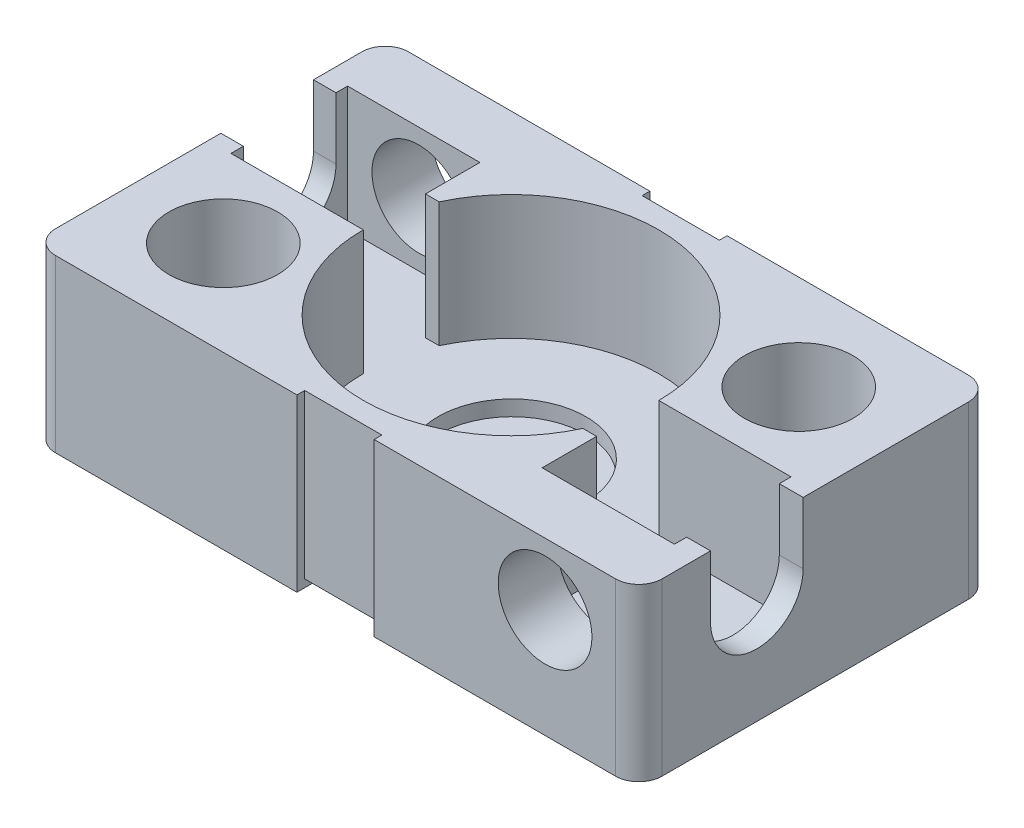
SolidWorks part; units mm, degrees
ref_plane "Front Plane" through (0, 0, 0) normal (0, 0, 1) x (1, 0, 0)
ref_plane "Top Plane" through (0, 0, 0) normal (0, 1, 0) x (1, 0, 0)
ref_plane "Right Plane" through (0, 0, 0) normal (1, 0, 0) x (0, 0, -1)
sketch "Sketch1" plane through (0, 0, 0) normal (0, 1, 0) x (1, 0, 0)
  line L0 (-31.2842, 0) -> (37.2174, 0) construction
  line L1 (0, 23.598) -> (0, -28.7221) construction
  line L3 (-25.39, 16) -> (25.39, 16)
  line L4 (-27.5, 13.89) -> (-27.5, -13.89)
  line L5 (-25.39, -16) -> (25.39, -16)
  line L6 (27.5, 13.89) -> (27.5, -13.89)
  arc A0 (27.5, -13.89) -> (25.39, -16) centre (25.39, -13.89) cw
  arc A1 (25.39, 16) -> (27.5, 13.89) centre (25.39, 13.89) cw
  arc A2 (-27.5, 13.89) -> (-25.39, 16) centre (-25.39, 13.89) cw
  arc A3 (-27.5, -13.89) -> (-25.39, -16) centre (-25.39, -13.89) ccw
  point P5 (-27.5, 16)
  point P16 (-27.5, 16)
  point P18 (-27.5, 16)
  dimension "D1" = 2.11
extrude "Extrude2" add sketch "Sketch1" against normal blind 15.5
sketch "Sketch7" plane through (0, 0, 0) normal (0, 1, 0) x (1, 0, 0)
  line L0 (-0.059, 15.9705) -> (-0.059, -16.0295) construction
  line L1 (-27.559, -0.0295) -> (27.441, -0.0295)
  line L2 (-13.459, -0.0295) -> (-13.459, 10.5505)
  line L3 (13.341, -10.6095) -> (13.341, -0.0295)
  line L4 (12.0963, -5.6695) -> (13.341, -5.6695)
  line L5 (-12.2142, 5.6105) -> (-13.459, 5.6105)
  line L6 (-13.459, 10.5505) -> (-25.459, 10.5505)
  line L7 (-25.459, 10.5505) -> (-25.459, -0.0295)
  line L8 (13.341, -10.6095) -> (25.341, -10.6095)
  line L9 (25.341, -10.6095) -> (25.341, -0.0295)
  circle A0 centre (-18.749, -7.4295) radius 4.93
  circle A1 centre (18.631, 7.3705) radius 4.93
  arc A2 (-13.459, -0.0295) -> (12.0963, -5.6695) centre (-0.059, -0.0295) ccw
  arc A3 (13.341, -0.0295) -> (-12.2142, 5.6105) centre (-0.059, -0.0295) ccw
  circle A4 centre (-0.059, -0.0295) radius 6.7
  point P4 (-18.749, -7.4295)
  point P7 (18.631, 7.3705)
  point P11 (25.341, -10.6095)
extrude "Cut-Extrude5" cut sketch "Sketch7" against normal blind 11.3
sketch "Sketch8" plane through (0, -11.3, 0) normal (0, 1, 0) x (1, 0, 0)
  circle A0 centre (0, 0) radius 6.7
extrude "Cut-Extrude6" cut sketch "Sketch8" against normal blind 1.4
sketch "Sketch9" plane through (0, 0, 16) normal (0, 0, 1) x (1, 0, 0)
  line L0 (0, 3.0152) -> (0, -19.459) construction
  circle A0 centre (19, -5.64) radius 4.25
  point P3 (19, -5.64)
extrude "Cut-Extrude7" cut sketch "Sketch9" against normal up to vertex (5.3905 mm away)
sketch "Sketch10" plane through (0, 0, -16) normal (0, 0, -1) x (-1, 0, 0)
  line L0 (0, 0) -> (0, -18.3383) construction
  circle A0 centre (19, -5.64) radius 4.25
  point P3 (19, -5.64)
extrude "Cut-Extrude8" cut sketch "Sketch10" against normal blind 7.4
sketch "Sketch12" plane through (-27.5, 0, 0) normal (-1, 0, 0) x (0, 0, 1)
  line L0 (0.0295, 2.0484) -> (0.0295, -17.6856) construction
  line L1 (-13.89, -5.6) -> (14.7576, -5.6) construction
  line L2 (-13.89, -15.5) -> (-13.89, 0) construction
  line L3 (-9.5, -5.6) -> (-9.5, 0)
  line L4 (-13.89, 0) -> (13.89, 0) construction
  line L5 (-1.1, -5.6) -> (-1.1, 0)
  arc A0 (-9.5, -5.6) -> (-1.1, -5.6) centre (-5.3, -5.6) ccw
  point P3 (-5.3, -5.6)
extrude "Cut-Extrude10" cut sketch "Sketch12" against normal blind 2.11
sketch "Sketch14" plane through (27.5, 0, 0) normal (1, 0, 0) x (0, 0, -1)
  line L0 (-1.1, -5.6) -> (-1.1, 0)
  line L1 (-13.89, 0) -> (13.89, 0) construction
  line L2 (-9.5, -5.6) -> (-9.5, 0)
  arc A0 (-9.5, -5.6) -> (-1.1, -5.6) centre (-5.3, -5.6) ccw
  point P0 (-5.3, -5.6)
extrude "Cut-Extrude13" cut sketch "Sketch14" against normal blind 2.5
sketch "Sketch15" plane through (0, 0, 0) normal (0, 1, 0) x (1, 0, 0)
  line L0 (0, 18.6516) -> (0, -19.5355) construction
  line L1 (0, 16) -> (-3.5, 16)
  line L2 (25.39, 16) -> (-25.39, 16) construction
  line L3 (-3.5, 16) -> (-3.5, 15.3)
  line L4 (-3.5, 15.3) -> (3.5, 15.3)
  line L5 (3.5, 15.3) -> (3.5, 16)
  line L6 (3.5, 16) -> (0, 16)
  line L7 (30.2332, 0) -> (-28.1992, 0) construction
  line L9 (-3.5, -16) -> (-3.5, -15.3)
  line L10 (3.5, -15.3) -> (3.5, -16)
  line L11 (3.5, -16) -> (0, -16)
  line L12 (0, -16) -> (-3.5, -16)
  line L13 (-3.5, -15.3) -> (3.5, -15.3)
extrude "Cut-Extrude14" cut sketch "Sketch15" against normal through all
sketch "Sketch16" plane through (0, 0, 15.3) normal (0, 0, 1) x (1, 0, 0)
  line L0 (0, 1.0046) -> (0, -16.498) construction
  line L1 (-3.5, -14.8) -> (3.5, -14.8)
  line L2 (-3.5, -15.5) -> (-3.5, 0) construction
  line L3 (3.5, -15.5) -> (3.5, 0) construction
  line L4 (-3.5, -14.8) -> (-3.5, -15.5)
  line L5 (-3.5, -15.5) -> (3.5, -15.5)
  line L6 (3.5, -15.5) -> (3.5, -14.8)
extrude "Cut-Extrude15" cut sketch "Sketch16" against normal blind 2.8
sketch "Sketch17" plane through (0, 0, -15.3) normal (0, 0, -1) x (-1, 0, 0)
  line L0 (0, 3.4899) -> (0, -17.0397) construction
  line L1 (-3.5, -14.8) -> (3.5, -14.8)
  line L2 (-3.5, -15.5) -> (-3.5, 0) construction
  line L3 (3.5, -15.5) -> (3.5, 0) construction
  line L4 (3.5, -14.8) -> (3.5, -15.5)
  line L5 (3.5, -15.5) -> (-3.5, -15.5)
  line L6 (-3.5, -15.5) -> (-3.5, -14.8)
extrude "Cut-Extrude16" cut sketch "Sketch17" against normal blind 2.8
